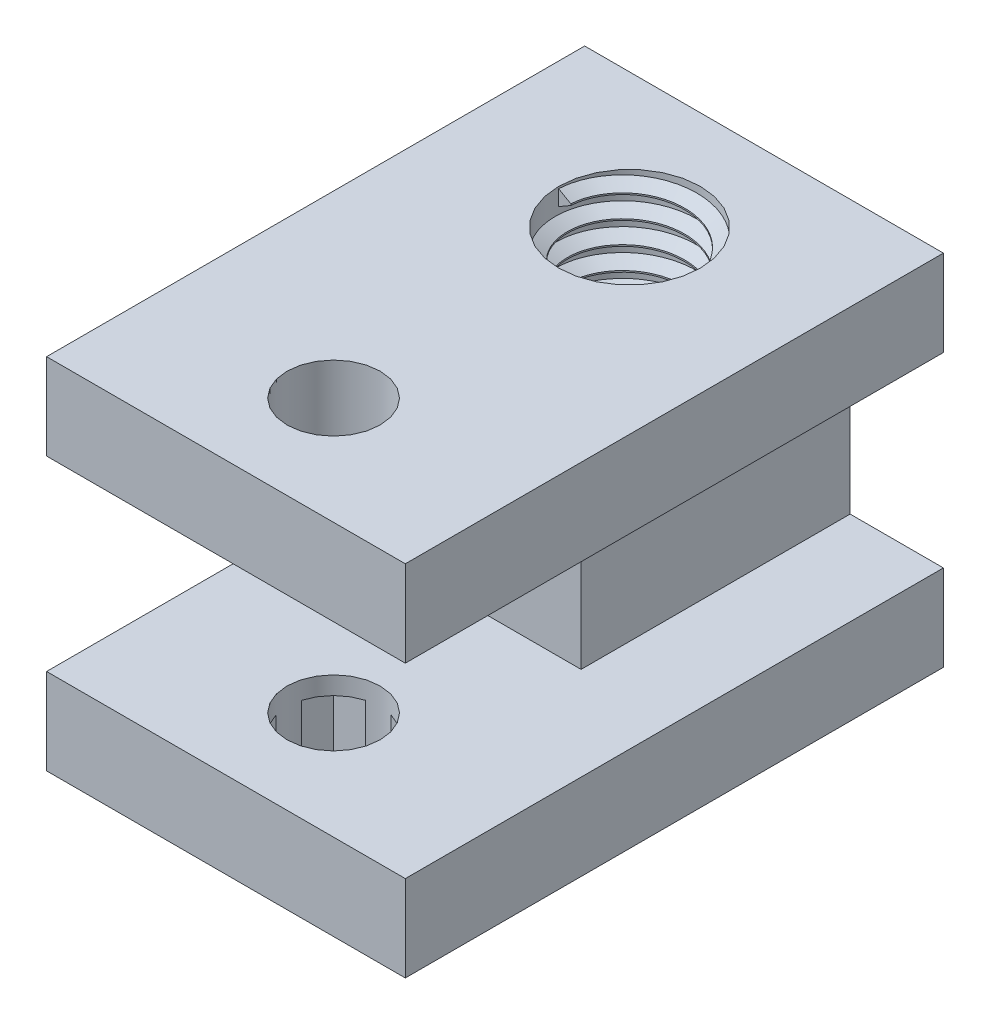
SolidWorks part; units mm, degrees
ref_plane "Front Plane" through (0, 0, 0) normal (0, 0, 1) x (1, 0, 0)
ref_plane "Top Plane" through (0, 0, 0) normal (0, 1, 0) x (1, 0, 0)
ref_plane "Right Plane" through (0, 0, 0) normal (1, 0, 0) x (0, 0, -1)
sketch "Sketch1" plane through (0, 0, 0) normal (0, 1, 0) x (1, 0, 0)
  line L0 (0, -25.4) -> (0, -17.78) construction
  line L1 (12.7, 12.7) -> (-12.7, 12.7)
  line L2 (12.7, 12.7) -> (12.7, -6.35)
  line L4 (-12.7, 12.7) -> (-12.7, -6.35)
  line L5 (12.7, 12.7) -> (-12.7, -6.35) construction
  line L6 (12.7, -6.35) -> (-12.7, 12.7) construction
  line L8 (-12.7, -6.35) -> (-12.7, -25.4)
  line L9 (-12.7, -25.4) -> (12.7, -25.4)
  line L10 (12.7, -6.35) -> (12.7, -25.4)
  circle A0 centre (0, 3.175) radius 4.7625
  circle A1 centre (0, -17.78) radius 3.302
  point P0 (0, 0)
  point P14 (0, -18.6565)
extrude "Boss-Extrude1" add sketch "Sketch1" along normal blind 25.4
thread "Thread1" pitch 1.5875 start angle 0, offset 0, length 23.876, pitch 1.5875, diameter 9.525
ref_plane "Plane1" through (-4.7625, 25.4, -3.175) normal (0, 0, 1) x (-1, 0, 0)
sketch "Thread Profile1" plane through (-4.7625, 25.4, -3.175) normal (0, 0, 1) x (-1, 0, 0)
  line L0 (0, 0) -> (0, 1.5875) construction
  line L11 (0, 0) -> (0, 1.3891)
  line L12 (0, 1.3891) -> (-0.8593, 0.893)
  line L13 (-0.8593, 0.893) -> (-0.8593, 0.4961)
  line L15 (-0.8593, 0.4961) -> (0, 0)
  line L17 (-0.8593, 0.6945) -> (0, 0.6945) construction
  point P2 (0, 0)
  dimension "Pitch" = 1.5875
  dimension "Profile_Angle" = 60
  dimension "Profile_Land" = 0.3969
  dimension "Profile_Height" = 0.8593
sketch "Sketch6" plane through (0, 25.4, 0) normal (0, 1, 0) x (1, 0, 0)
  line L0 (12.7, 12.7) -> (-12.7, 12.7) construction
  line L1 (0, 12.7) -> (0, 15.875) construction
  line L2 (-6.35, 12.7) -> (6.35, 12.7)
  arc A0 (6.35, 12.7) -> (-6.35, 12.7) centre (0, 12.7) ccw
  circle A1 centre (0, 15.875) radius 1.5875
extrude "Boss-Extrude2" [suppressed] add sketch "Sketch6" against normal blind 14.2875
sketch "Sketch7" [suppressed] plane through (0, 25.4, 0) normal (0, 1, 0) x (1, 0, 0)
  line L0 (-6.35, 12.7) -> (6.35, 12.7)
  arc A0 (-6.35, 12.7) -> (6.35, 12.7) centre (0, 12.7) cw
extrude "Cut-Extrude1" [suppressed] cut sketch "Sketch7" against normal blind 11.1125
sketch "Sketch8" plane through (0, 0, 25.4) normal (0, 0, 1) x (1, 0, 0)
  line L0 (-6.096, 12.7) -> (6.096, 12.7) construction
  line L2 (-12.7, 25.4) -> (-12.7, 0) construction
  line L4 (12.7, 25.4) -> (12.7, 0) construction
  line L7 (-12.7, 12.7) -> (-12.7, 19.304)
  line L8 (-12.7, 19.304) -> (-6.096, 19.304)
  line L9 (-6.096, 12.7) -> (-6.096, 19.304)
  line L11 (12.7, 12.7) -> (12.7, 19.304)
  line L12 (12.7, 19.304) -> (6.096, 19.304)
  line L13 (6.096, 12.7) -> (6.096, 19.304)
  line L15 (-12.7, 12.7) -> (-12.7, 6.096)
  line L16 (-12.7, 6.096) -> (-6.096, 6.096)
  line L17 (-6.096, 12.7) -> (-6.096, 6.096)
  line L19 (12.7, 12.7) -> (12.7, 6.096)
  line L20 (12.7, 6.096) -> (6.096, 6.096)
  line L21 (6.096, 12.7) -> (6.096, 6.096)
extrude "Cut-Extrude2" cut sketch "Sketch8" against normal blind 38.1
other "Move Face3" parameters "D1"=0.254
sketch "Sketch9" plane through (0, 0, 25.4) normal (0, 0, 1) x (1, 0, 0)
  line L1 (-6.096, 19.304) -> (6.096, 19.304)
  line L2 (-6.096, 19.304) -> (-6.096, 6.096)
  line L3 (-6.096, 6.096) -> (6.096, 6.096)
  line L4 (6.096, 19.304) -> (6.096, 6.096)
extrude "Cut-Extrude3" cut sketch "Sketch9" against normal blind 19.05
sketch "Sketch11" plane through (0, 0, 0) normal (0, -1, 0) x (1, 0, 0)
  line L1 (3.175, 20.955) -> (-3.175, 20.955)
  line L2 (3.175, 20.955) -> (3.175, 14.605)
  line L3 (3.175, 14.605) -> (-3.175, 14.605)
  line L4 (-3.175, 20.955) -> (-3.175, 14.605)
  line L5 (3.175, 20.955) -> (-3.175, 14.605) construction
  line L6 (3.175, 14.605) -> (-3.175, 20.955) construction
  point P0 (0, 17.78)
extrude "Cut-Extrude4" cut sketch "Sketch11" against normal blind 4.826
